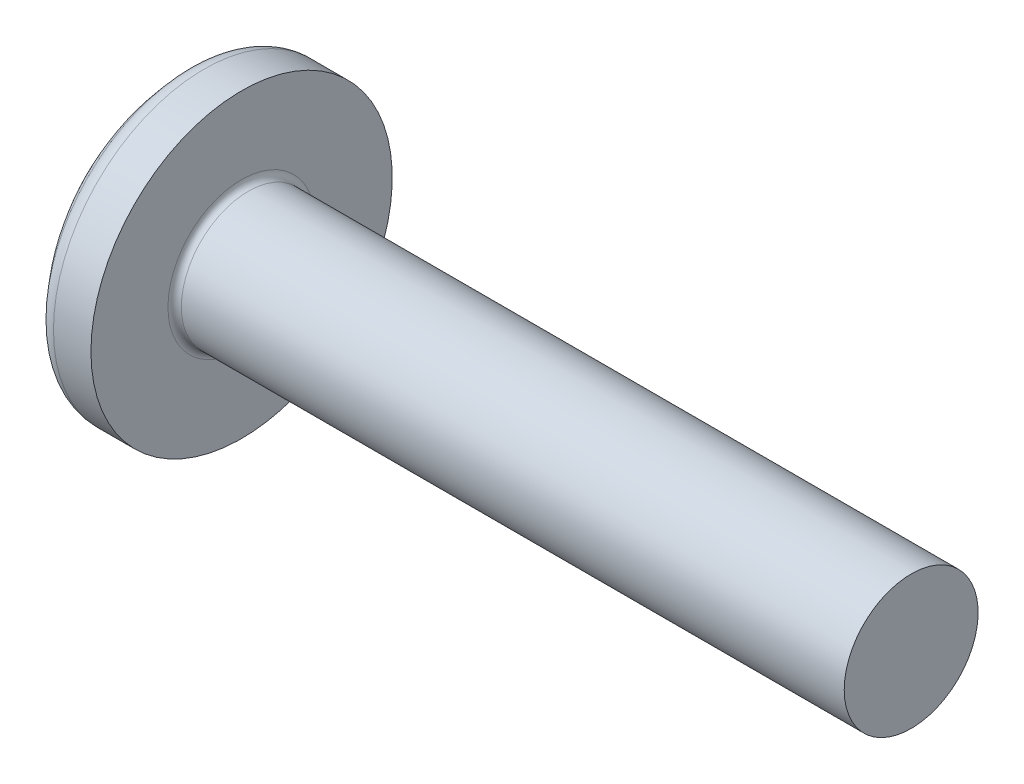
SolidWorks part; units mm, degrees
ref_plane "Plane1" through (0, 0, 0) normal (0, 0, 1) x (1, 0, 0)
ref_plane "Plane2" through (0, 0, 0) normal (0, 1, 0) x (1, 0, 0)
ref_plane "Plane3" through (0, 0, 0) normal (1, 0, 0) x (0, 0, -1)
sketch "BodySke" plane through (0, 0, 0) normal (0, 0, 1) x (1, 0, 0)
  line L0 (1.6, 1) -> (1.6, 2.25)
  line L2 (-25.4, 0) -> (127, 0) construction
  line L3 (11.6, 0) -> (0, 0)
  line L4 (1.6, 1) -> (11.6, 1)
  line L5 (11.6, 1) -> (11.6, 0)
  line L6 (1.0403, 2.25) -> (1.6, 2.25)
  arc A0 (0.8412, 2.1625) -> (0, 0) centre (3.2, 0) ccw
  arc A2 (0.8412, 2.1625) -> (1.0403, 2.25) centre (1.0403, 1.98) cw
  dimension "Head_fillet_rad" = 0.27
  dimension "Head_crown_rad" = 3.2
  dimension "D1" = 10
  dimension "Head_ht" = 1.6
  dimension "Diameter" = 2
  dimension "Head_dia" = 4.5
revolve "Base-Revolve" add sketch "BodySke"
fillet "Fillet1" radius 0.1 1 edges at (1.6, 0, 1)
sketch "Sketch3" plane through (0, 0, 0) normal (1, 0, 0) x (0, 0, -1)
  line L0 (0.37, -0.95) -> (-0.37, -0.95)
  line L1 (0.37, -0.95) -> (0.37, 0.95)
  line L2 (-0.37, 0.95) -> (0.37, 0.95)
  line L3 (-0.37, 0.95) -> (-0.37, -0.95)
  dimension "D1" = 0.95
  dimension "Cross_dia" = 1.9
  dimension "D2" = 0.37
  dimension "Cross_width" = 0.74
ref_plane "Plane4" through (1.75, 0, 0) normal (1, 0, 0) x (0, 0, -1)
sketch "Sketch4" plane through (1.75, 0, 0) normal (1, 0, 0) x (0, 0, -1)
  line L0 (0.37, -0.5275) -> (-0.37, -0.5275)
  line L1 (0.37, -0.5275) -> (0.37, 0.5275)
  line L2 (-0.37, 0.5275) -> (0.37, 0.5275)
  line L3 (-0.37, 0.5275) -> (-0.37, -0.5275)
  dimension "D1" = 0.74
  dimension "D2" = 1.055
  dimension "D3" = 0.37
  dimension "D4" = 0.5275
loft "Recess" cut profiles "Sketch3", "Sketch4"
pattern_circular "RecPat" count 2 every 90 about axis through (0, 0, 0) along (1, 0, 0) of "Recess"
sketch "RecCorSke" plane through (0, 0, 0) normal (0, 0, 1) x (1, 0, 0)
  line L0 (-3.175, 0) -> (15.875, 0) construction
  line L1 (-25.4, 0) -> (127, 0) construction
  line L2 (0, 0) -> (0, 0.6784)
  line L3 (0, 0.6784) -> (1.75, 0.556)
  line L4 (1.75, 0.556) -> (1.9307, 0)
  line L5 (1.9307, 0) -> (0, 0)
  dimension "Diameter" = 1.112
  dimension "Depth" = 1.75
  dimension "Draft_angle" = 4
  dimension "Bottom_angle" = 18
revolve "RecessCore" cut sketch "RecCorSke" angle 360 about L0
